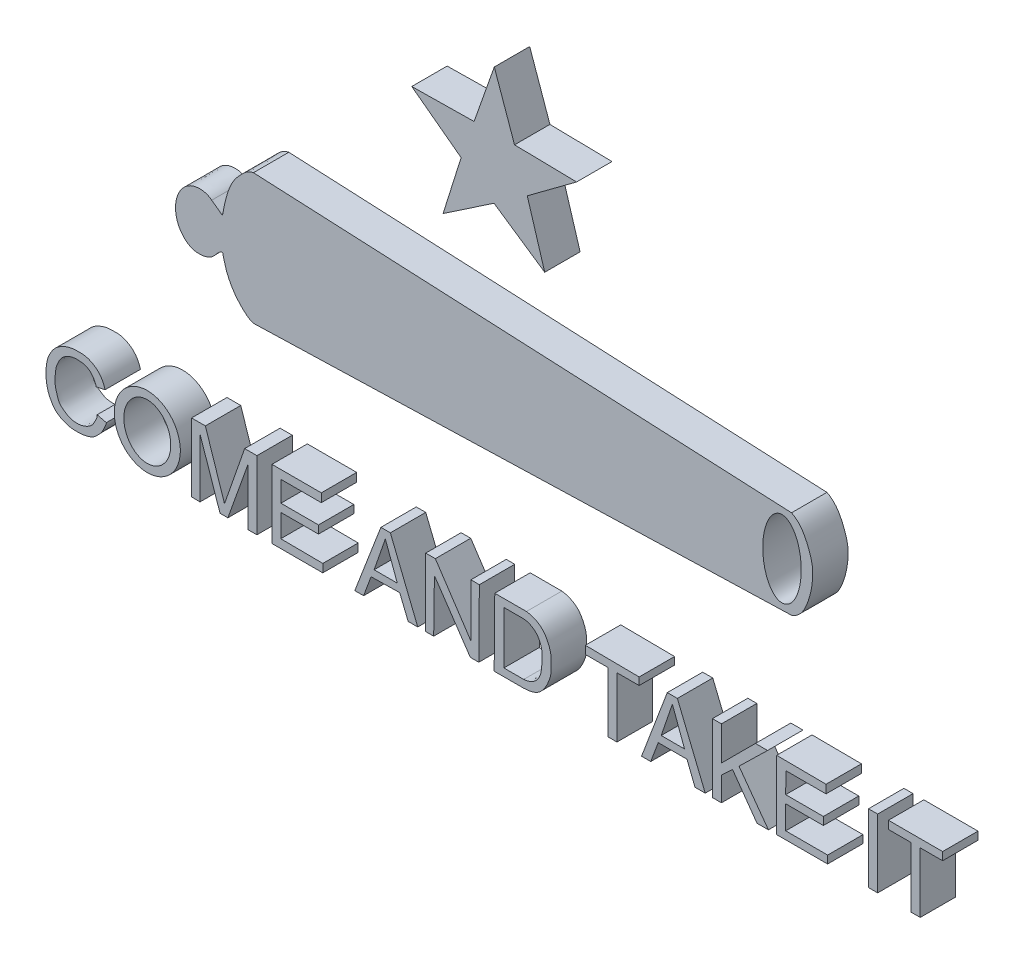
SolidWorks part; units mm, degrees
ref_plane "Front Plane" through (0, 0, 0) normal (0, 0, 1) x (1, 0, 0)
ref_plane "Top Plane" through (0, 0, 0) normal (0, 1, 0) x (1, 0, 0)
ref_plane "Right Plane" through (0, 0, 0) normal (1, 0, 0) x (0, 0, -1)
sketch "Sketch1" plane through (0, 0, 0) normal (0, 0, 1) x (1, 0, 0)
  line L0 (36.9951, 8.1554) -> (36.3855, 8.1554)
  line L1 (33.1851, 13.0335) -> (33.8756, 13.0335)
  line L2 (20.82, 30.4927) -> (59.436, 28.6645)
  line L3 (33.7566, 8.1554) -> (33.1851, 8.1554)
  line L4 (59.436, 22.2941) -> (20.82, 21.1337)
  line L5 (36.4251, 12.9953) -> (37.0332, 12.9953)
  line L6 (9.5367, 11.5411) -> (10.1786, 11.6819)
  line L7 (9.6068, 9.8429) -> (10.2648, 9.6815)
  line L9 (17.3716, 13.0335) -> (18.7452, 8.8795)
  line L10 (18.7452, 8.8795) -> (20.193, 13.0335)
  line L11 (21.0715, 13.0335) -> (21.0715, 8.1125)
  line L12 (20.4389, 8.1125) -> (20.4389, 12.195)
  line L13 (20.4389, 12.195) -> (18.9886, 8.1269)
  line L14 (18.4252, 8.1269) -> (16.9959, 12.3127)
  line L15 (16.9959, 12.3127) -> (16.986, 8.1125)
  line L16 (16.383, 8.1269) -> (16.383, 13.0335)
  line L17 (22.15, 13.0335) -> (25.6921, 13.0335)
  line L18 (25.6921, 12.4216) -> (22.7913, 12.4216)
  line L19 (22.7913, 12.4216) -> (22.7913, 10.9374)
  line L20 (22.7913, 10.9374) -> (25.4889, 10.9374)
  line L21 (25.4889, 10.3658) -> (22.7838, 10.3658)
  line L22 (22.7838, 10.3658) -> (22.7838, 8.726)
  line L23 (22.7838, 8.726) -> (25.8, 8.7013)
  line L24 (25.8, 8.1125) -> (22.15, 8.1125)
  line L25 (22.15, 8.1125) -> (22.15, 13.0335)
  line L26 (30.6468, 13.0253) -> (32.6136, 8.1554)
  line L27 (31.9262, 8.1554) -> (31.3182, 9.6417)
  line L28 (31.3182, 9.6417) -> (29.2608, 9.6036)
  line L29 (29.2608, 9.6036) -> (28.7274, 8.1554)
  line L30 (28.0937, 8.1554) -> (29.9666, 13.0253)
  line L31 (33.8756, 13.0335) -> (36.4251, 9.1996)
  line L32 (36.4251, 9.1996) -> (36.4251, 12.9953)
  line L33 (37.0332, 12.9953) -> (36.9951, 8.1554)
  line L34 (36.3855, 8.1554) -> (33.808, 11.95)
  line L35 (33.808, 11.95) -> (33.7566, 8.1554)
  line L36 (33.1851, 8.1554) -> (33.1851, 13.0335)
  line L37 (44.6398, 13.0332) -> (48.5013, 12.9953)
  line L38 (48.5013, 12.4618) -> (46.9102, 12.4618)
  line L39 (46.9102, 12.4618) -> (46.9102, 8.154)
  line L40 (46.2534, 8.154) -> (46.2534, 12.4618)
  line L41 (46.2534, 12.4618) -> (44.6398, 12.4618)
  line L42 (51.2434, 13.0335) -> (53.244, 8.1444)
  line L43 (52.512, 8.1444) -> (51.9366, 9.5983)
  line L44 (51.9366, 9.5983) -> (49.869, 9.5983)
  line L45 (49.869, 9.5983) -> (49.3335, 8.154)
  line L46 (48.6724, 8.154) -> (50.5206, 13.0335)
  line L47 (54.4068, 13.0335) -> (54.4068, 10.5968)
  line L48 (57.7174, 13.0335) -> (55.6667, 11.0332)
  line L49 (55.6667, 11.0332) -> (57.7781, 8.13)
  line L50 (56.9591, 8.13) -> (55.2052, 10.5968)
  line L51 (53.7591, 8.1255) -> (53.7591, 13.0335)
  line L52 (58.3692, 13.0592) -> (61.9125, 13.0335)
  line L53 (61.9125, 12.4333) -> (59.0315, 12.4333)
  line L54 (59.0315, 12.4333) -> (59.0169, 10.9374)
  line L55 (59.0169, 10.9374) -> (61.722, 10.9374)
  line L56 (61.722, 10.3721) -> (59.0168, 10.3721)
  line L57 (59.0168, 10.3721) -> (59.0168, 8.689)
  line L58 (59.0168, 8.689) -> (62.0268, 8.689)
  line L59 (62.0268, 8.1328) -> (58.3692, 8.13)
  line L60 (58.3692, 8.13) -> (58.3692, 13.0592)
  line L61 (65.6179, 13.0335) -> (65.6179, 8.1328)
  line L62 (64.9605, 8.1328) -> (64.9605, 13.0335)
  line L63 (66.3901, 13.0335) -> (70.2773, 13.0335)
  line L64 (70.2773, 12.4618) -> (68.6722, 12.4618)
  line L65 (68.6722, 12.4618) -> (68.6722, 8.1328)
  line L66 (68.0028, 8.1328) -> (68.0028, 12.4618)
  line L67 (68.0028, 12.4618) -> (66.3901, 12.4618)
  line L68 (38.1062, 45.7062) -> (39.5584, 41.5928)
  line L69 (39.5584, 41.5928) -> (44.0124, 41.5113)
  line L70 (44.0124, 41.5113) -> (40.4722, 38.8816)
  line L71 (40.4722, 38.8816) -> (41.7244, 34.7561)
  line L72 (41.7244, 34.7561) -> (38.086, 37.2271)
  line L73 (38.086, 37.2271) -> (34.4302, 34.7561)
  line L74 (34.4302, 34.7561) -> (35.7254, 38.8816)
  line L75 (35.7254, 38.8816) -> (32.1826, 41.5306)
  line L76 (32.1826, 41.5306) -> (36.6571, 41.5928)
  line L77 (36.6571, 41.5928) -> (38.1062, 45.7062)
  line L78 (29.9666, 13.0253) -> (30.6468, 13.0253)
  line L79 (29.4825, 10.1464) -> (30.2875, 12.4618)
  line L80 (30.2875, 12.4618) -> (31.1457, 10.1464)
  line L81 (31.1457, 10.1464) -> (29.4825, 10.1464)
  line L82 (28.0937, 8.1554) -> (28.7274, 8.1554)
  line L83 (31.9262, 8.1554) -> (32.6136, 8.1554)
  line L84 (25.8, 8.1125) -> (25.8, 8.7013)
  line L85 (25.4889, 10.3658) -> (25.4889, 10.9374)
  line L86 (25.6921, 12.4216) -> (25.6921, 13.0335)
  line L87 (20.4389, 8.1125) -> (21.0715, 8.1125)
  line L88 (20.193, 13.0335) -> (21.0715, 13.0335)
  line L89 (18.4252, 8.1269) -> (18.9886, 8.1269)
  line L90 (16.986, 8.1125) -> (16.383, 8.1269)
  line L91 (16.383, 13.0335) -> (17.3716, 13.0335)
  line L92 (44.6398, 13.0332) -> (44.6398, 12.4618)
  line L93 (48.5013, 12.9953) -> (48.5013, 12.4618)
  line L94 (46.2534, 8.154) -> (46.9102, 8.154)
  line L95 (48.6724, 8.154) -> (49.3335, 8.154)
  line L96 (52.512, 8.1444) -> (53.244, 8.1444)
  line L97 (54.4068, 10.5968) -> (56.8427, 13.0335)
  line L98 (50.5206, 13.0335) -> (51.2434, 13.0335)
  line L99 (50.8861, 12.4999) -> (50.0821, 10.1464)
  line L100 (50.0821, 10.1464) -> (51.7587, 10.1464)
  line L101 (51.7587, 10.1464) -> (50.8861, 12.4999)
  line L102 (53.7591, 13.0335) -> (54.4068, 13.0335)
  line L103 (53.7591, 8.1255) -> (54.4068, 8.1255)
  line L104 (56.9591, 8.13) -> (57.7781, 8.13)
  line L105 (61.722, 10.3721) -> (61.722, 10.9374)
  line L106 (61.9125, 12.4333) -> (61.9125, 13.0335)
  line L107 (62.0268, 8.1328) -> (62.0268, 8.689)
  line L108 (64.9605, 13.0335) -> (65.6179, 13.0335)
  line L109 (64.9605, 8.1328) -> (65.6179, 8.1328)
  line L110 (38.1406, 13.0179) -> (38.0968, 8.1514)
  line L111 (68.0028, 8.1328) -> (68.6722, 8.1328)
  line L112 (66.3901, 12.4618) -> (66.3901, 13.0335)
  line L113 (70.2773, 12.4618) -> (70.2773, 13.0335)
  line L114 (56.8427, 13.0335) -> (57.7174, 13.0335)
  line L115 (55.2052, 10.5968) -> (54.4068, 9.857)
  line L116 (54.4068, 9.857) -> (54.4068, 8.1255)
  line L117 (38.0968, 8.1514) -> (40.2206, 8.1514)
  line L118 (38.1406, 13.0179) -> (40.4125, 13.0179)
  line L119 (40.2206, 8.7013) -> (38.7965, 8.7013)
  line L120 (38.7965, 8.7013) -> (38.7965, 12.4618)
  line L121 (38.7965, 12.4618) -> (40.2206, 12.4618)
  ellipse E0 centre (13.2052, 10.5958) end of major axis (13.2305, 8.0446) minor radius 2.3698
  ellipse E2 centre (58.752, 25.4685) end of major axis (58.752, 28.2133) minor radius 1.3812
  ellipse E3 centre (13.2052, 10.5958) end of major axis (13.2052, 12.5761) minor radius 1.6842
  spline S0 degree 3 poles (17.828, 27.2856) (17.4024, 27.6327) (16.3831, 27.663) (15.4298, 26.7125) (15.1205, 25.5295) (15.4392, 24.3029) (16.2594, 23.536) (17.1224, 23.4727) (17.8906, 23.6958) (18.2111, 24.2043) (18.4966, 24.4296) (18.5607, 24.4166) knots 0 0 0 0 0.186788 0.296685 0.444061 0.588488 0.717634 0.799818 0.878909 0.979986 1 1 1 1
  spline S1 degree 3 poles (17.828, 27.2856) (18.0126, 27.1504) (18.4842, 26.8281) (18.5312, 26.755) knots 0 0 0 0 1 1 1 1
  spline S2 degree 3 poles (20.82, 30.4927) (20.4117, 30.4275) (19.9837, 30.001) (19.4122, 29.3526) (19.0685, 28.6679) (18.8633, 27.989) (18.7309, 27.4173) (18.6504, 26.9789) (18.6256, 26.8067) (18.5738, 26.7324) (18.5312, 26.755) knots 0 0 0 0 0.2546 0.380765 0.562119 0.748481 0.832757 0.962236 0.97896 1 1 1 1
  spline S3 degree 3 poles (20.82, 21.1337) (20.4297, 21.2673) (19.9866, 21.683) (19.4346, 22.3303) (19.0895, 22.918) (18.8596, 23.4685) (18.7351, 23.9378) (18.6403, 24.2533) (18.623, 24.431) (18.5607, 24.4166) knots 0 0 0 0 0.290562 0.431015 0.614236 0.780846 0.857482 0.970399 1 1 1 1
  spline S4 degree 3 poles (59.436, 28.6645) (60.0638, 28.3552) (60.5935, 27.3748) (60.9563, 26.1926) (60.9617, 25.3938) (60.8862, 24.6399) (60.571, 23.4574) (60.0912, 22.5181) (59.436, 22.2941) knots 0 0 0 0 0.273352 0.432751 0.499757 0.596869 0.739925 1 1 1 1
  spline S5 degree 3 poles (40.2206, 12.4618) (40.5905, 12.4306) (41.1365, 12.1363) (41.4756, 11.449) (41.5702, 10.8462) (41.517, 10.2328) (41.4588, 9.5738) (41.0548, 8.9115) (40.5215, 8.7194) (40.2206, 8.7013) knots 0 0 0 0 0.216502 0.331903 0.43747 0.570131 0.691807 0.82186 1 1 1 1
  spline S6 degree 3 poles (9.5367, 11.5411) (9.4723, 11.8717) (9.1102, 12.43) (8.4278, 12.5624) (7.9311, 12.5689) (7.5189, 12.4485) (7.0605, 12.1545) (6.8455, 11.7845) (6.6439, 11.334) (6.5934, 10.7903) (6.5556, 10.2466) (6.7205, 9.6896) (6.8576, 9.1923) (7.2894, 8.8607) (7.7228, 8.6043) (8.0511, 8.5881) (8.3538, 8.5854) (8.7301, 8.6707) (9.1733, 8.9098) (9.3182, 9.1192) (9.4417, 9.329) (9.5168, 9.4676) (9.5821, 9.6233) (9.5805, 9.5989) (9.6068, 9.8429) knots 0 0 0 0 0.117047 0.171813 0.218545 0.265665 0.312289 0.367205 0.414976 0.459944 0.537239 0.580927 0.641017 0.690752 0.747005 0.787856 0.797323 0.84168 0.888081 0.932033 0.939191 0.957385 0.963694 1 1 1 1
  spline S7 degree 3 poles (40.4125, 13.0179) (40.8383, 12.9667) (41.5051, 12.6801) (41.982, 11.8766) (42.1989, 11.2599) (42.178, 10.6372) (42.2123, 10.1099) (42.0422, 9.5075) (41.7631, 8.9255) (41.2013, 8.258) (40.5621, 8.1701) (40.2206, 8.1514) knots 0 0 0 0 0.191149 0.289804 0.402843 0.471551 0.56131 0.632462 0.742344 0.844349 1 1 1 1
  spline S8 degree 3 poles (10.1786, 11.6819) (10.0837, 12.0261) (9.8109, 12.536) (9.228, 12.9128) (8.7464, 13.0979) (8.2152, 13.0978) (7.6499, 13.0703) (7.139, 12.8612) (6.6757, 12.5943) (6.3354, 12.172) (6.0621, 11.6525) (5.9555, 11.1166) (5.9267, 10.5415) (5.9572, 10.0113) (6.0912, 9.4738) (6.3127, 9.0268) (6.5595, 8.6321) (6.9182, 8.38) (7.2447, 8.2193) (7.6687, 8.0845) (8.1791, 8.0527) (8.6963, 8.0979) (9.1063, 8.207) (9.4347, 8.369) (9.6925, 8.651) (9.9708, 8.9238) (10.1101, 9.303) (10.2606, 9.5284) (10.2648, 9.6815) knots 0 0 0 0 0.082356 0.124489 0.15618 0.198662 0.244335 0.28426 0.323359 0.365024 0.405904 0.456462 0.487995 0.537351 0.577094 0.613307 0.651172 0.681527 0.711813 0.734115 0.782596 0.827231 0.85206 0.879251 0.909226 0.938728 0.96688 1 1 1 1
extrude "Boss-Extrude1" add sketch "Sketch1" along normal blind 2.54
